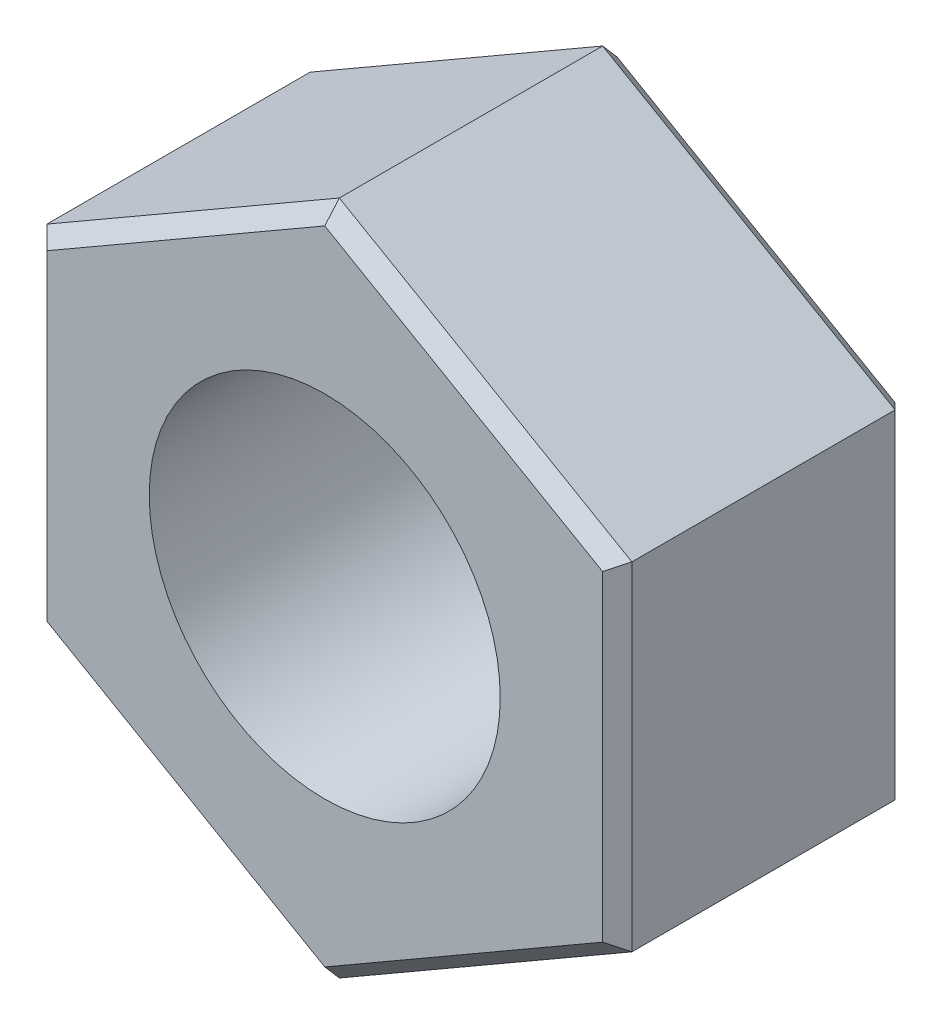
SolidWorks part; units mm, degrees
ref_plane "Plan de face" through (0, 0, 0) normal (0, 0, 1) x (1, 0, 0)
ref_plane "Plan de dessus" through (0, 0, 0) normal (0, 1, 0) x (1, 0, 0)
ref_plane "Plan de droite" through (0, 0, 0) normal (1, 0, 0) x (0, 0, -1)
sketch "Esquisse1" plane through (0, 0, 0) normal (0, 0, 1) x (1, 0, 0)
  line L1 (0, 5.7735) -> (-5, 2.8868)
  line L2 (-5, 2.8868) -> (-5, -2.8868)
  line L3 (-5, -2.8868) -> (0, -5.7735)
  line L4 (0, -5.7735) -> (5, -2.8868)
  line L5 (5, -2.8868) -> (5, 2.8868)
  line L6 (5, 2.8868) -> (0, 5.7735)
  circle A0 centre (0, 0) radius 5 construction
  dimension "D1" = 10
extrude "Boss.-Extru.1" add sketch "Esquisse1" along normal blind 5
chamfer "Chanfrein1" distance 0.25 angle 45 12 edges at (-2.5, 4.3301, 0) (-5, 0, 0) (-2.5, -4.3301, 0) (2.5, -4.3301, 0) (5, 0, 0) (2.5, 4.3301, 0) (5, 0, 5) (2.5, -4.3301, 5) (-2.5, -4.3301, 5) (-5, 0, 5) (-2.5, 4.3301, 5) (2.5, 4.3301, 5)
sketch "Esquisse2" plane through (0, 0, 5) normal (0, 0, 1) x (1, 0, 0)
  circle A0 centre (0, 0) radius 3
  dimension "D1" = 6
extrude "Enlèv. mat.-Extru.1" cut sketch "Esquisse2" against normal through all
